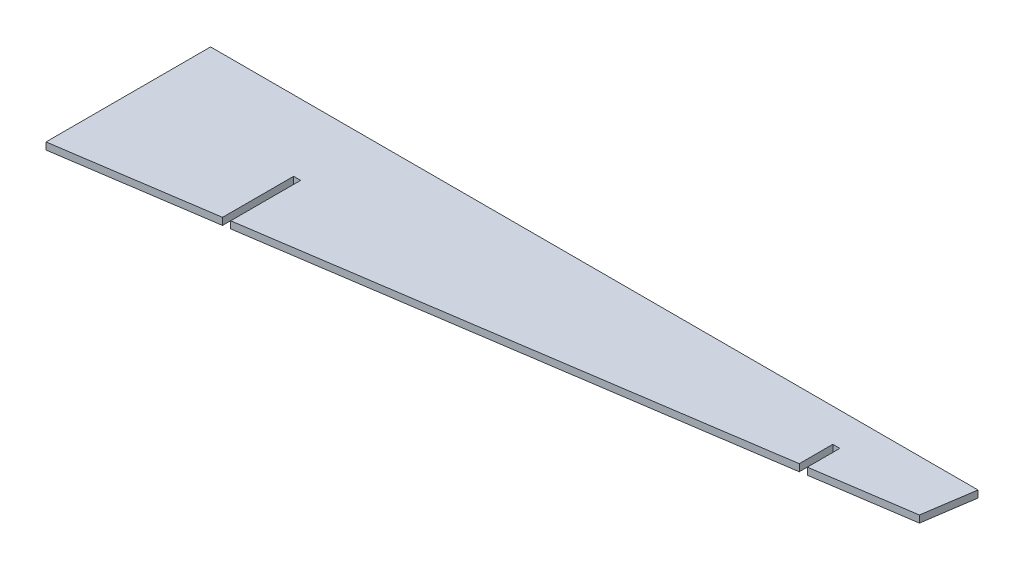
SolidWorks part; units mm, degrees
ref_plane "Front Plane" through (0, 0, 0) normal (0, 0, 1) x (1, 0, 0)
ref_plane "Top Plane" through (0, 0, 0) normal (0, 1, 0) x (1, 0, 0)
ref_plane "Right Plane" through (0, 0, 0) normal (1, 0, 0) x (0, 0, -1)
sketch "Sketch2" plane through (0, 0, 0) normal (0, 0, 1) x (1, 0, 0)
  line L0 (4.3656, -825.8969) -> (975.9156, -825.8969) construction
  line L1 (975.9156, -825.8969) -> (975.9156, -817.1656) construction
  line L2 (4.3656, -817.1656) -> (975.9156, -817.1656) construction
  line L3 (4.3656, -825.8969) -> (4.3656, -817.1656) construction
  line L4 (4.3656, -825.8969) -> (975.9156, -825.8969)
  line L5 (975.9156, -825.8969) -> (975.9156, -817.1656)
  line L6 (4.3656, -817.1656) -> (975.9156, -817.1656)
  line L7 (4.3656, -825.8969) -> (4.3656, -817.1656)
extrude "Boss-Extrude1" add sketch "Sketch2" along normal up to surface (204.1566 mm away)
sketch "Sketch3" plane through (0, -825.8969, 0) normal (0, -1, 0) x (1, 0, 0)
  line L0 (4.3656, 0) -> (975.9156, 0) construction
  line L1 (194.8656, 0) -> (203.5969, 0)
  line L2 (194.8656, 0) -> (194.8656, 87.5075)
  line L3 (194.8656, 87.5075) -> (203.5969, 87.5075)
  line L4 (203.5969, 0) -> (203.5969, 87.5075)
  line L5 (817.1656, 0) -> (825.8969, 0)
  line L6 (817.1656, 0) -> (817.1656, 40.9757)
  line L7 (817.1656, 40.9757) -> (825.8969, 40.9757)
  line L8 (825.8969, 0) -> (825.8969, 40.9757)
  line L10 (821.5312, 0) -> (821.5312, 40.9757) construction
  line L11 (821.5312, 40.9757) -> (821.5312, 81.9515) construction
  line L12 (4.3656, 204.1566) -> (975.9156, 58.8636) construction
  line L13 (199.2312, 0) -> (199.2312, 87.5075) construction
  line L14 (199.2312, 87.5075) -> (199.2312, 175.0149) construction
extrude "Cut-Extrude1" [suppressed] cut sketch "Sketch3" against normal through all
sketch "Sketch4" plane through (4.3656, 0, 0) normal (-1, 0, 0) x (0, 0, 1)
  line L1 (204.1566, -825.8969) -> (205.4624, -825.8969)
  line L2 (204.1566, -825.8969) -> (204.1566, -817.1656)
  line L3 (204.1566, -817.1656) -> (205.4624, -817.1656)
  line L4 (205.4624, -825.8969) -> (205.4624, -817.1656)
extrude "Cut-Extrude2" cut sketch "Sketch4" along direction (-0.989, 0, 0.1479) on the side against the normal through all
sketch "Sketch5" plane through (0, -817.1656, 0) normal (0, 1, 0) x (1, 0, 0)
  line L0 (4.3656, 0) -> (975.9156, 0) construction
  line L1 (194.8656, -87.5075) -> (203.5969, -87.5075)
  line L2 (194.8656, -87.5075) -> (194.8656, -175.6678)
  line L3 (194.8656, -175.6678) -> (203.5969, -174.3621)
  line L4 (203.5969, -87.5075) -> (203.5969, -174.3621)
  line L5 (817.1656, -40.9757) -> (825.8969, -40.9757)
  line L6 (817.1656, -40.9757) -> (817.1656, -82.6043)
  line L7 (817.1656, -82.6043) -> (825.8969, -81.2986)
  line L8 (825.8969, -40.9757) -> (825.8969, -81.2986)
  line L9 (199.2312, -175.0149) -> (199.2312, -87.5075) construction
  line L10 (199.2312, -87.5075) -> (199.2312, 0) construction
  line L11 (821.5312, -81.9515) -> (821.5312, -40.9757) construction
  line L12 (821.5312, -40.9757) -> (821.5312, 0) construction
  line L13 (975.9156, -58.8636) -> (4.3656, -204.1566) construction
extrude "Cut-Extrude3" cut sketch "Sketch5" against normal through all
ref_plane "Plane1" through (1160.1465, -173.4971, -711.0325) normal (-0.9784, 0.1463, -0.1463) x (-0.1447, -0.9892, -0.0216)
other "SurfaceCut1"
sketch "Sketch7" plane through (0, 0, 0) normal (0, 0, -1) x (-1, 0, 0)
  line L1 (-956.2485, -825.8969) -> (-957.5542, -825.8969)
  line L2 (-956.2485, -825.8969) -> (-956.2485, -817.1656)
  line L3 (-956.2485, -817.1656) -> (-957.5542, -817.1656)
  line L4 (-957.5542, -825.8969) -> (-957.5542, -817.1656)
extrude "Cut-Extrude4" cut sketch "Sketch7" along direction (-0.1479, 0, 0.989) on the side against the normal through all
